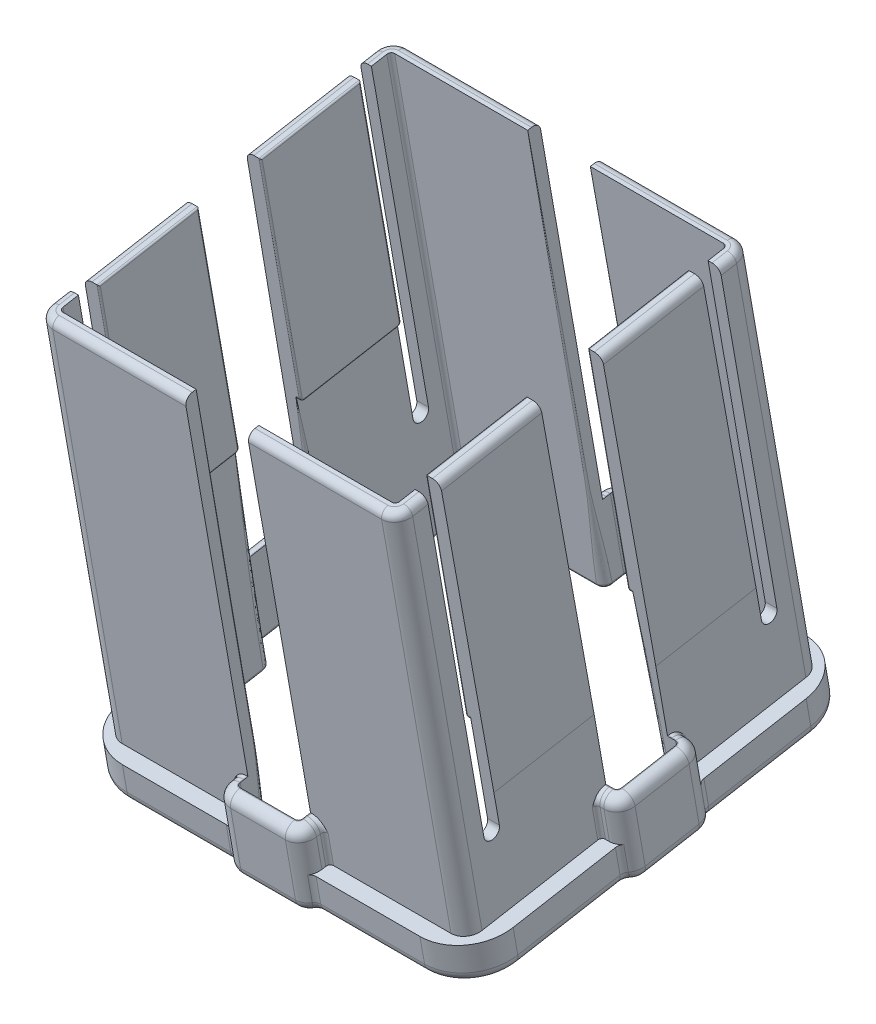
SolidWorks part; units mm, degrees
other "Cut-Extrude2[1]"
ref_plane "Front Plane" through (0, 0, 0) normal (0, 0, 1) x (1, 0, 0)
ref_plane "Top Plane" through (0, 0, 0) normal (0, 1, 0) x (1, 0, 0)
ref_plane "Right Plane" through (0, 0, 0) normal (1, 0, 0) x (0, 0, -1)
imported_body "SingleSensorSlot-Flat-CEAHelmet.STEP<1>"
fillet "Fillet1" radius 0.7
